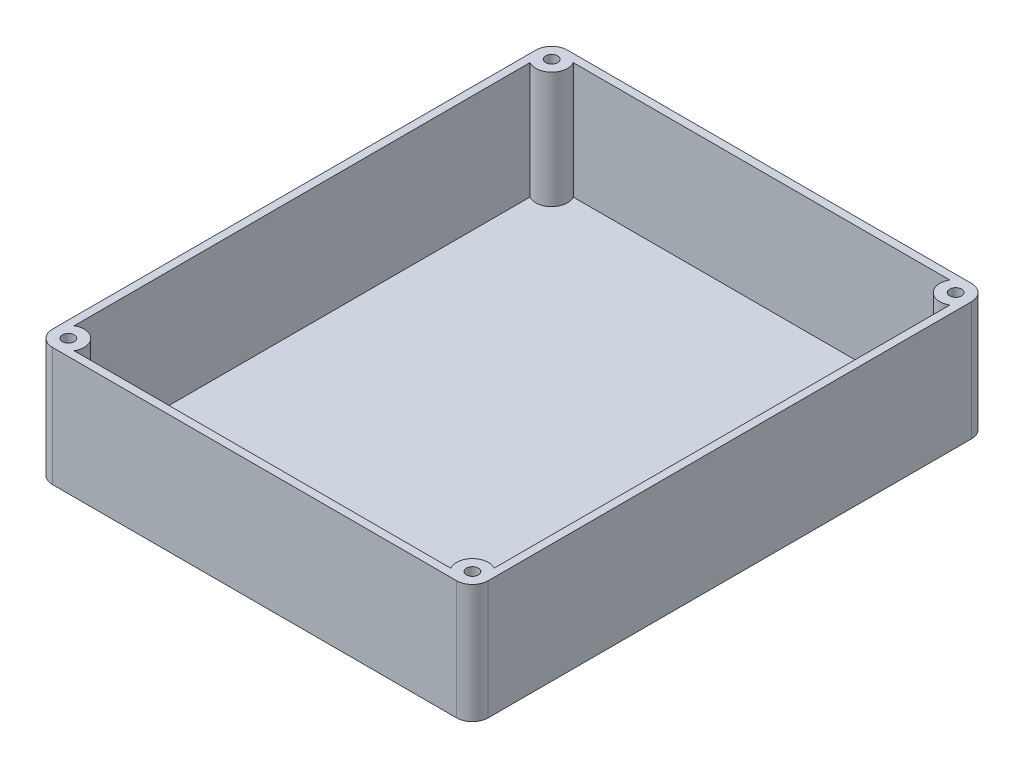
SolidWorks part; units mm, degrees
ref_plane "Front Plane" through (0, 0, 0) normal (0, 0, 1) x (1, 0, 0)
ref_plane "Top Plane" through (0, 0, 0) normal (0, 1, 0) x (1, 0, 0)
ref_plane "Right Plane" through (0, 0, 0) normal (1, 0, 0) x (0, 0, -1)
sketch "Sketch2" plane through (0, 0, 0) normal (0, 1, 0) x (1, 0, 0)
  line L0 (53, 63) -> (-53, 63)
  line L1 (55, 65) -> (-55, 65)
  line L2 (55, 65) -> (55, -65)
  line L3 (55, -65) -> (-55, -65)
  line L4 (-55, 65) -> (-55, -65)
  line L5 (55, 65) -> (-55, -65) construction
  line L6 (55, -65) -> (-55, 65) construction
  line L7 (-53, 63) -> (-53, -63)
  line L8 (53, -63) -> (-53, -63)
  line L9 (53, 63) -> (53, -63)
  point P0 (0, 0)
  dimension "D1" = 130
  dimension "D2" = 110
  dimension "D3" = 2
extrude "Boss-Extrude1" add sketch "Sketch2" along normal blind 30
sketch "Sketch3" plane through (0, 0, 0) normal (0, -1, 0) x (1, 0, 0)
  line L1 (-55, 65) -> (55, 65)
  line L2 (-55, 65) -> (-55, -65)
  line L3 (-55, -65) -> (55, -65)
  line L4 (55, 65) -> (55, -65)
extrude "Boss-Extrude2" add sketch "Sketch3" against normal blind 0.6
fillet "Fillet3" radius 4 4 edges at (55, 15, 65) (55, 15, -65) (-55, 15, -65) (-55, 15, 65)
sketch "Sketch5" plane through (0, 30, 0) normal (0, 1, 0) x (1, 0, 0)
  circle A0 centre (-51, 61) radius 4
  arc A1 (-51, 65) -> (-55, 61) centre (-51, 61) ccw construction
  circle A2 centre (51, 61) radius 4
  circle A3 centre (51, -61) radius 4
  circle A4 centre (-51, -61) radius 4
  arc A5 (-55, -61) -> (-51, -65) centre (-51, -61) ccw construction
  arc A6 (51, -65) -> (55, -61) centre (51, -61) ccw construction
  arc A7 (55, 61) -> (51, 65) centre (51, 61) ccw construction
  circle A8 centre (51, 61) radius 1.5
  circle A9 centre (51, -61) radius 1.5
  circle A10 centre (-51, -61) radius 1.5
  circle A11 centre (-51, 61) radius 1.5
  dimension "D1" = 3
extrude "Boss-Extrude3" add sketch "Sketch5" against normal up to surface (29.4 mm away)
